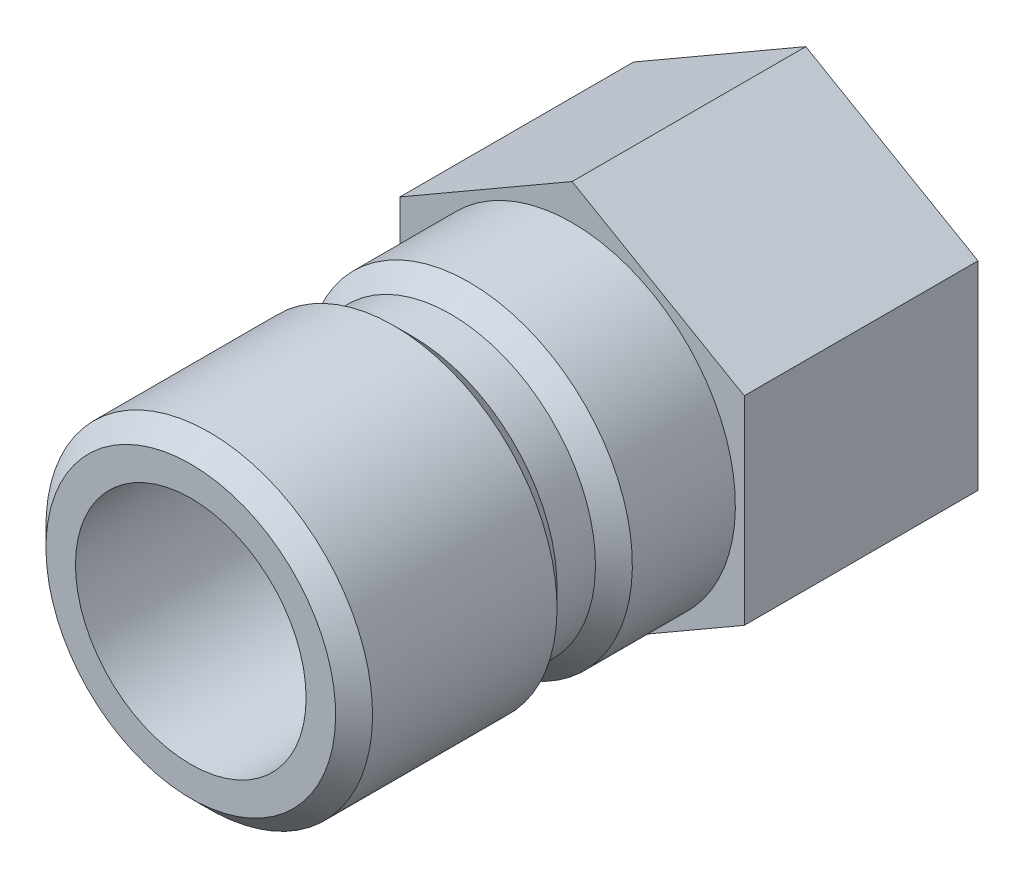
SolidWorks part; units mm, degrees
ref_plane "Front Plane" through (0, 0, 0) normal (0, 0, 1) x (1, 0, 0)
ref_plane "Top Plane" through (0, 0, 0) normal (0, 1, 0) x (1, 0, 0)
ref_plane "Right Plane" through (0, 0, 0) normal (1, 0, 0) x (0, 0, -1)
sketch "Sketch1" plane through (0, 0, 0) normal (1, 0, 0) x (0, 0, -1)
  line L0 (0, 0) -> (-18.923, 0) construction
  line L1 (-15.748, 4.7625) -> (-15.748, 5.9817)
  line L2 (-6.604, 5.9817) -> (-6.604, 0) construction
  line L3 (-14.986, 6.7437) -> (-7.366, 6.7437)
  line L4 (0, 8.7312) -> (0, 0) construction
  line L5 (-6.604, 5.9817) -> (-5.0165, 5.9817)
  line L6 (-4.2545, 6.7437) -> (0, 6.7437)
  line L7 (0, 6.7437) -> (0, 8.7312)
  line L8 (-6.604, 5.9817) -> (-7.366, 6.7437)
  line L9 (-5.0165, 5.9817) -> (-4.2545, 6.7437)
  line L10 (-15.748, 5.9817) -> (-14.986, 6.7437)
  line L11 (-15.748, 4.7625) -> (1.7145, 4.7625)
  line L12 (0, 8.7312) -> (9.652, 8.7312)
  line L13 (1.7145, 4.7625) -> (1.7145, 4.3053)
  line L14 (9.652, 8.7312) -> (9.652, 4.5533)
  line L15 (1.7145, 4.3053) -> (9.652, 4.5533)
  dimension "D1" = 15.748
  dimension "D2" = 1.5875
  dimension "D3" = 0.762
  dimension "D4" = 45
  dimension "D5" = 9.144
  dimension "D6" = 45
  dimension "D7" = 17.4625
  dimension "D8" = 9.525
  dimension "D9" = 25.4
  dimension "D10" = 3.175
  dimension "D11" = 8.6106
  dimension "D12" = 7.9375
  dimension "D13" = 1.79
  dimension "D14" = 13.4874
revolve "Revolve1" add sketch "Sketch1" angle 360 about L0
sketch "Sketch2" plane through (0, 0, 0) normal (0, 0, 1) x (1, 0, 0)
  line L1 (-7.112, 4.1061) -> (-7.112, -4.1061)
  line L2 (-7.112, -4.1061) -> (0, -8.2122)
  line L3 (0, -8.2122) -> (7.112, -4.1061)
  line L4 (7.112, -4.1061) -> (7.112, 4.1061)
  line L5 (7.112, 4.1061) -> (0, 8.2122)
  line L6 (0, 8.2122) -> (-7.112, 4.1061)
  circle A0 centre (0, 0) radius 7.112 construction
  dimension "D1" = 14.224
extrude "Cut-Extrude1" cut sketch "Sketch2" against normal through all flip side to cut
